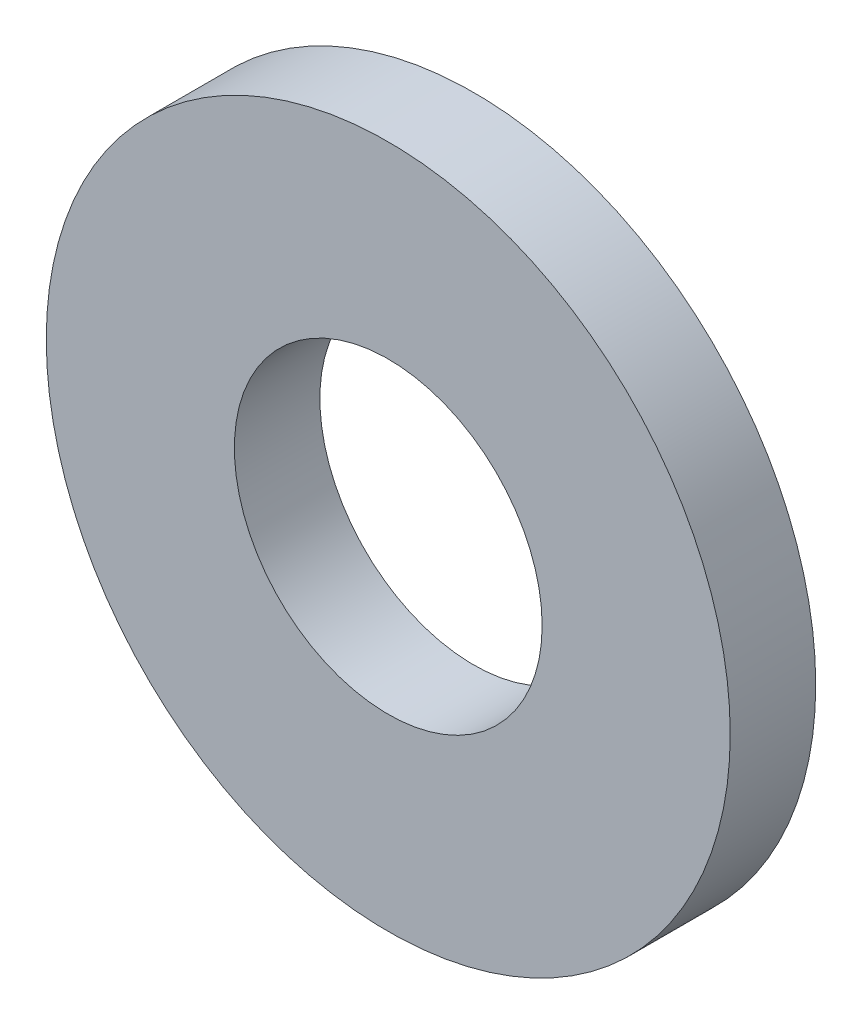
SolidWorks part; units mm, degrees
ref_plane "Plan1" through (0, 0, 0) normal (0, 0, 1) x (1, 0, 0)
ref_plane "Plan2" through (0, 0, 0) normal (0, 1, 0) x (1, 0, 0)
ref_plane "Plan3" through (0, 0, 0) normal (1, 0, 0) x (0, 0, -1)
sketch "Esquisse1" plane through (0, 0, 0) normal (0, 0, 1) x (1, 0, 0)
  circle A0 centre (0, 0) radius 10
  circle A1 centre (0, 0) radius 4.5
  dimension "D1" = 9
  dimension "D2" = 20
extrude "Extrusion1" add sketch "Esquisse1" along normal blind 2.5
